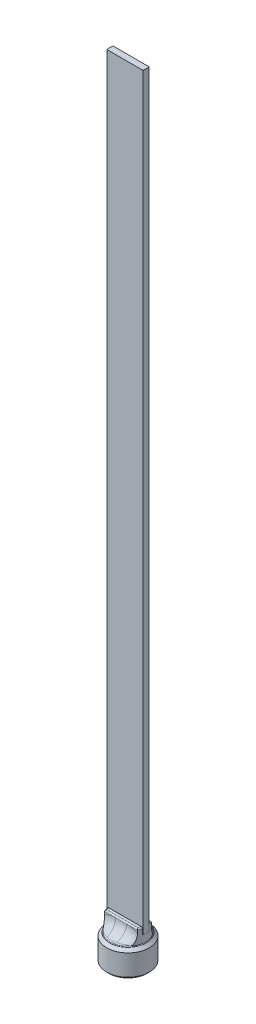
SolidWorks part; units mm, degrees
ref_plane "Front Plane" through (0, 0, 0) normal (0, 0, 1) x (1, 0, 0)
ref_plane "Top Plane" through (0, 0, 0) normal (0, 1, 0) x (1, 0, 0)
ref_plane "Right Plane" through (0, 0, 0) normal (1, 0, 0) x (0, 0, -1)
imported_body "Imported1"
sketch "Sketch1" plane through (0, 13.335, 0) normal (0, 1, 0) x (1, 0, 0)
  line L0 (-7.0111, 1.1938) -> (7.0111, 1.1938)
  line L1 (7.0111, -1.1938) -> (-7.0111, -1.1938)
  line L2 (6.8307, 1.1938) -> (-6.8307, 1.1938) construction
  line L3 (-6.8307, -1.1938) -> (6.8307, -1.1938) construction
  arc A0 (-7.0111, 1.1938) -> (-7.0111, -1.1938) centre (0, 0) ccw
  arc A1 (7.0111, -1.1938) -> (7.0111, 1.1938) centre (0, 0) ccw
  dimension "D1" = 14.224
extrude "Boss-Extrude1" add sketch "Sketch1" along normal offset from surface (291.465 mm away) 304.8
